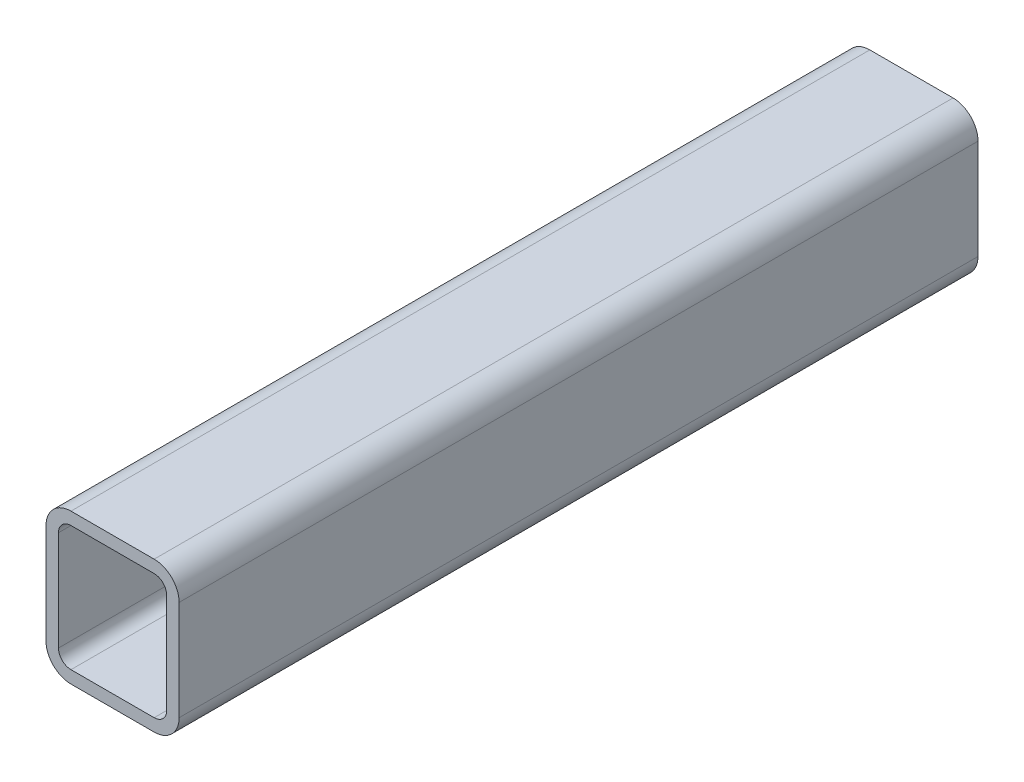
SolidWorks part; units mm, degrees
ref_plane "Front Plane" through (0, 0, 0) normal (0, 0, 1) x (1, 0, 0)
ref_plane "Top Plane" through (0, 0, 0) normal (0, 1, 0) x (1, 0, 0)
ref_plane "Right Plane" through (0, 0, 0) normal (1, 0, 0) x (0, 0, -1)
sketch "Sketch1" plane through (0, 0, 0) normal (0, 0, 1) x (1, 0, 0)
  line B0 (9.525, 57.15) -> (41.275, 57.15)
  arc B1 (50.8, 47.625) -> (41.275, 57.15) centre (41.275, 47.625) ccw
  line B2 (50.8, 47.625) -> (50.8, 9.525)
  arc B3 (41.275, 0) -> (50.8, 9.525) centre (41.275, 9.525) ccw
  line B4 (41.275, 0) -> (9.525, 0)
  arc B5 (0, 9.525) -> (9.525, 0) centre (9.525, 9.525) ccw
  line B6 (0, 9.525) -> (0, 47.625)
  arc B7 (9.525, 57.15) -> (0, 47.625) centre (9.525, 47.625) ccw
  line B8 (9.525, 52.3875) -> (41.275, 52.3875)
  arc B9 (46.0375, 47.625) -> (41.275, 52.3875) centre (41.275, 47.625) ccw
  line B10 (46.0375, 47.625) -> (46.0375, 9.525)
  arc B11 (41.275, 4.7625) -> (46.0375, 9.525) centre (41.275, 9.525) ccw
  line B12 (41.275, 4.7625) -> (9.525, 4.7625)
  arc B13 (4.7625, 9.525) -> (9.525, 4.7625) centre (9.525, 9.525) ccw
  line B14 (4.7625, 9.525) -> (4.7625, 47.625)
  arc B15 (9.525, 52.3875) -> (4.7625, 47.625) centre (9.525, 47.625) ccw
sketch_block_instance "HSS2.25x2x0.1875-1"
sketch_block "HSS2.25x2x0.1875"
extrude "Boss-Extrude1" add sketch "Sketch1" along normal blind 304.8
